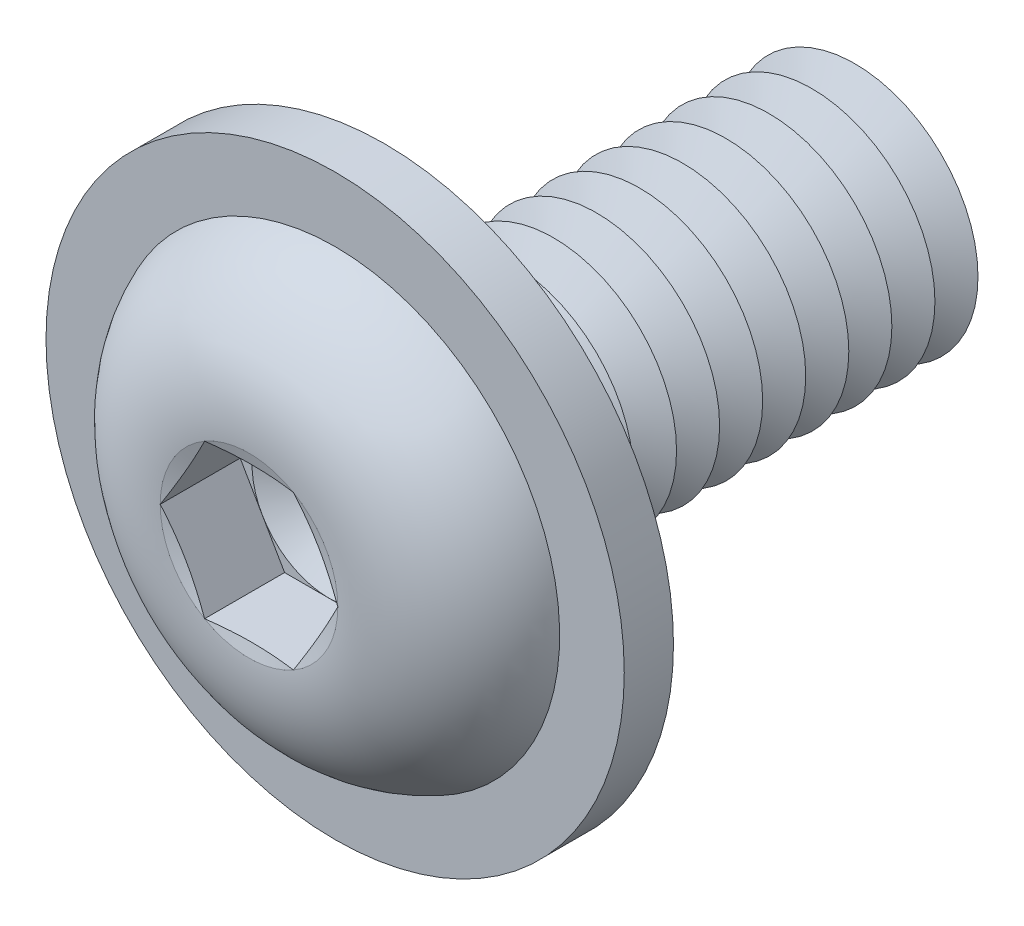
SolidWorks part; units mm, degrees
ref_plane "Front Plane" through (0, 0, 0) normal (0, 0, 1) x (1, 0, 0)
ref_plane "Top Plane" through (0, 0, 0) normal (0, 1, 0) x (1, 0, 0)
ref_plane "Right Plane" through (0, 0, 0) normal (1, 0, 0) x (0, 0, -1)
sketch "Sketch1" plane through (0, 0, 0) normal (1, 0, 0) x (0, 0, -1)
  line L0 (0, 2) -> (0, 3.8)
  line L3 (0, 2) -> (8, 2)
  line L4 (8, 2) -> (8, 0)
  line L5 (8, 0) -> (-2.2, 0) construction
  line L6 (-2.2, 0) -> (8, 0)
  line L7 (-2.2, 1.4434) -> (-2.2, 0.7217) construction
  line L8 (-2.2, 0.7217) -> (-2.2, 0)
  line L9 (-2.2, 1.4434) -> (-2.0066, 0.7217)
  line L10 (-2.0066, 0.7217) -> (-2.2, 0.7217)
  line L11 (8, 0) -> (22.7481, 0) construction
  line L12 (0, 3.8) -> (-2.2, 3.8) construction
  arc A1 (0, 3.8) -> (-2.2, 1.4434) centre (0, 1.5948) ccw
  point P8 (8, 1)
  dimension "D1" = 7.6
  dimension "D2" = 4
  dimension "D3" = 2.2
  dimension "D4" = 2.8868
  dimension "D5" = 8
  dimension "D6" = 15
revolve "Revolve1" add sketch "Sketch1" angle 360 about L5
fillet "Fillet1" radius 0.35 1 edges at (-2, 0, 0)
sketch "Sketch2" plane through (0, 0, 0) normal (1, 0, 0) x (0, 0, -1)
  line L0 (7.65, 2) -> (8.35, 2)
  line L1 (8, 2) -> (0.35, 2) construction
  line L2 (8.35, 2) -> (8, 1.3938)
  line L3 (8, -2) -> (8, 2) construction
  line L4 (8, 1.3938) -> (7.65, 2)
  dimension "D1" = 0.7
revolve "Cut-Revolve1" cut sketch "Sketch2" angle 360 about axis through (0, 0, -8) along (0, 0, -1)
pattern_linear "LPattern1" count 11 spacing 0.7 along (0, 0, 1) of "Cut-Revolve1"
sketch "Sketch3" plane through (0, 0, 2.2) normal (0, 0, 1) x (1, 0, 0)
  line L7 (0.7217, 1.25) -> (-0.7217, 1.25)
  line L8 (-0.7217, 1.25) -> (-1.4434, 0)
  line L9 (-1.4434, 0) -> (-0.7217, -1.25)
  line L10 (-0.7217, -1.25) -> (0.7217, -1.25)
  line L11 (0.7217, -1.25) -> (1.4434, 0)
  line L12 (1.4434, 0) -> (0.7217, 1.25)
  circle A0 centre (0, 0) radius 1.25 construction
  circle A3 centre (0, 0) radius 1.4434 construction
extrude "Cut-Extrude1" cut sketch "Sketch3" against normal blind 1.3
sketch "Sketch4" plane through (0, 0, 0.9) normal (0, 0, 1) x (1, 0, 0)
  line L1 (0.7217, 1.25) -> (-0.7217, 1.25) construction
  circle A0 centre (0, 0) radius 1.25
extrude "Cut-Extrude2" cut sketch "Sketch4" against normal through all draft 60
sketch "Sketch5" plane through (0, 0, 0) normal (0, 0, -1) x (-1, 0, 0)
  circle A0 centre (0, 0) radius 4.7
  circle A1 centre (0, 0) radius 2.35
  circle A2 centre (0, 0) radius 2.35 construction
  dimension "D1" = 9.4
extrude "Boss-Extrude1" add sketch "Sketch5" against normal blind 0.8
